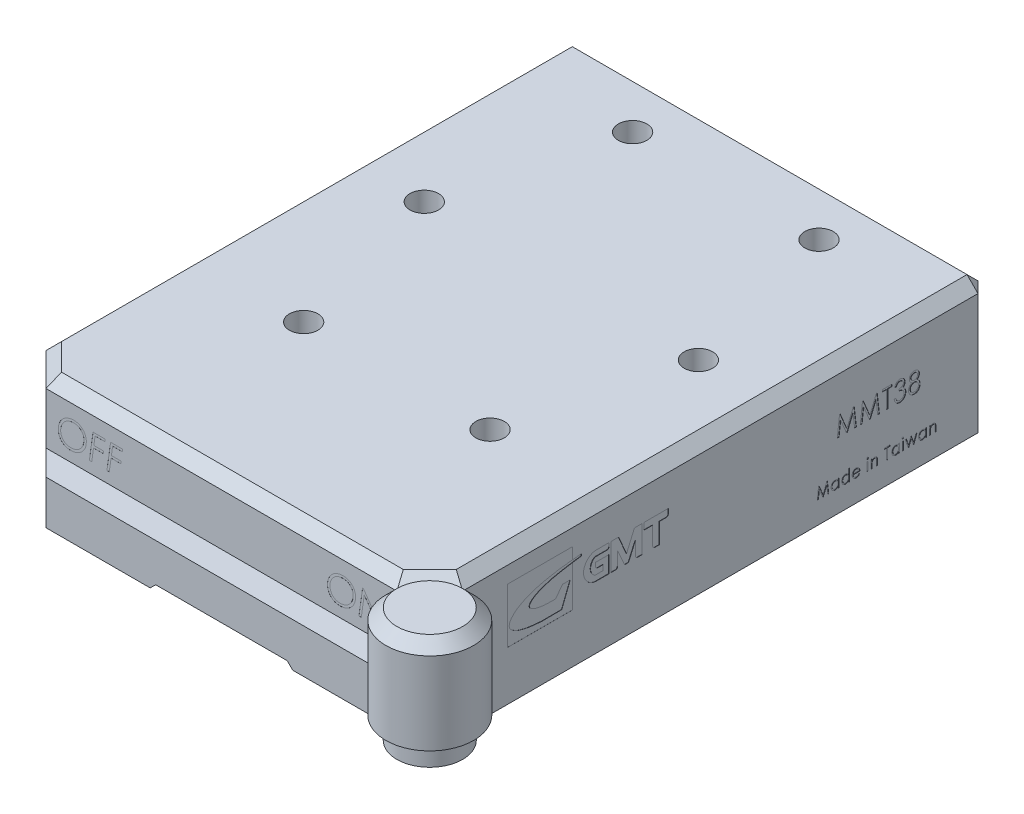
SolidWorks part; units mm, degrees
ref_plane "前基準面" through (0, 0, 0) normal (0, 0, 1) x (1, 0, 0)
ref_plane "上基準面" through (0, 0, 0) normal (0, 1, 0) x (1, 0, 0)
ref_plane "右基準面" through (0, 0, 0) normal (1, 0, 0) x (0, 0, -1)
sketch "草圖1" plane through (0, 0, 0) normal (0, 0, 1) x (1, 0, 0)
  line L0 (0, 53.9333) -> (0, 0) construction
  line L1 (-33.7631, 0) -> (44.506, 0) construction
  line L2 (-19, 0) -> (-19, 12)
  line L3 (-19, 12) -> (19, 12)
  line L4 (19, 12) -> (19, 0)
  line L5 (19, 0) -> (6, 0)
  line L6 (6, 0.5) -> (-6, 0.5)
  line L7 (-6, 0.5) -> (-6, 0)
  line L8 (-6, 0) -> (-19, 0)
  line L9 (6, 0.5) -> (6, 0)
  dimension "D1" = 12
  dimension "D2" = 38
  dimension "D3" = 13
  dimension "D4" = 0.5
extrude "伸長1" add sketch "草圖1" against normal blind 51
chamfer "導角1" distance 3 angle 45 2 edges at (-19, 6, 0) (19, 6, 0)
ref_plane "平面1" through (0, 4, 0) normal (0, 1, 0) x (-1, 0, 0)
sketch "草圖5" plane through (-19, 0, 0) normal (-1, 0, 0) x (0, 0, 1)
  line L0 (0, 12) -> (0, 0) construction
  line L1 (-4.3, 6.3) -> (0, 6.3)
  line L2 (-4.3, 6.3) -> (-4.3, 4)
  line L3 (-4.3, 4) -> (0, 4)
  line L4 (0, 6.3) -> (0, 4)
  line L5 (-51, 0) -> (-3, 0) construction
  dimension "D1" = 4
  dimension "D2" = 2.3
  dimension "D3" = 4.3
extrude "除料-伸長1" cut sketch "草圖5" against normal through all
sketch "草圖2" plane through (0, 4, 0) normal (0, 1, 0) x (-1, 0, 0)
  line L0 (0, 0) -> (0, -51) construction
  line L1 (-19, -51) -> (19, -51) construction
  line L2 (-12.4005, -10.8421) -> (-24.4213, 1.1787)
  line L3 (0, -19) -> (-31.0095, 12.0095) construction
  line L4 (-16, 0) -> (16, 0) construction
  line L5 (-20.1787, 5.4213) -> (-8.1579, -6.5995)
  line L6 (-8.1579, -6.5995) -> (-12.4005, -10.8421)
  arc A0 (-20.1787, 5.4213) -> (-24.4213, 1.1787) centre (-22.3, 3.3) ccw
  dimension "D3" = 6
  dimension "D1" = 45
  dimension "D2" = 6
  dimension "D4" = 20
  dimension "D5" = 6.3
  dimension "D6" = 32
extrude "伸長2" add sketch "草圖2" along normal blind 2
sketch "草圖3" plane through (0, 6, 0) normal (0, 1, 0) x (1, 0, 0)
  circle A0 centre (22.3, -3.3) radius 4
  dimension "D1" = 8
extrude "伸長3" add sketch "草圖3" along normal blind 8.5
sketch "草圖4" plane through (0, 4, 0) normal (0, -1, 0) x (1, 0, 0)
  circle A0 centre (22.3, 3.3) radius 1.5
  dimension "D1" = 3
extrude "伸長4" add sketch "草圖4" along normal blind 0.5
chamfer "導角2" distance 1 angle 45 9 edges at (22.3, 14.5, 7.3) (19, 6, -51) (-19, 6, -51) (0, 12, -51) (19, 12, -27) (17.5, 12, -1.5) (0, 12, 0) (-17.5, 12, -1.5) (-19, 12, -27)
chamfer "導角3" distance 0.5 angle 45 2 edges at (6, 0, -25.5) (-6, 0, -25.5)
fillet "圓角2" radius 1 1 edges at (10.4574, 5, -4.3)
hole_wizard "M3x0.5 螺紋孔1" positions "草圖9" profile "草圖8" tap size "M3x0.5" standard "JIS"
sketch "草圖9" plane through (0, 12, 0) normal (0, 1, 0) x (-1, 0, 0)
  line L0 (0, -54.1924) -> (0, 5.5667) construction
  line L2 (18, -51) -> (-18, -51) construction
  point P0 (-8.5, -46)
  point P1 (8.5, -46)
  point P3 (12.5, -31)
  point P5 (-12.5, -31)
  point P7 (8.5, -16)
  point P9 (-8.5, -16)
  dimension "D1" = 17
  dimension "D2" = 25
  dimension "D3" = 5
  dimension "D4" = 15
  dimension "D5" = 15
sketch "草圖8" plane through (8.5, 12, -46) normal (1, 0, 0) x (0, 0, 1)
  line L0 (0, 0) -> (0, 7.2811)
  line L1 (0, 7.2811) -> (1.3, 6.5)
  line L2 (1.3, 6.5) -> (1.3, 0)
  line L5 (1.3, 0) -> (0, 0)
  line L10 (0, 7.2811) -> (-1.3, 6.5) construction
  line L11 (0, -6.35) -> (0, 107.95) construction
  dimension "螺孔鑽直徑" = 2.6
  dimension "螺孔鑽深度" = 6.5
  dimension "導頭角度" = 118
sketch "草圖10" plane through (0, 0, 0) normal (0, 0, 1) x (1, 0, 0)
  line L0 (-15, 7.3) -> (15, 7.3) construction
  line L1 (-19, 6.3) -> (-19, 11) construction
  line L4 (19, 6.3) -> (-19, 6.3) construction
  text T0 "<i>OFF                    ON</i>" font "Century Gothic" height 2.4
  dimension "D1" = 4
  dimension "D2" = 1
extrude "除料-伸長2" cut sketch "草圖10" against normal blind 0.005
sketch "草圖11" plane through (19, 0, 0) normal (1, 0, 0) x (0, 0, -1)
  line L0 (51, 11) -> (51, 0) construction
  line L1 (3.4142, 12) -> (50, 12) construction
  line L2 (7.1, 9.5) -> (13, 9.5)
  line L3 (7.1, 9.5) -> (7.1, 4.5)
  line L4 (7.1, 4.5) -> (13, 4.5)
  line L5 (13, 9.5) -> (13, 4.5)
  dimension "D1" = 5
  dimension "D2" = 5.9
  dimension "D3" = 38
  dimension "D4" = 2.5
extrude "除料-伸長3" cut sketch "草圖11" against normal blind 0.005
sketch "草圖12"
  dimension "D1" = 2
  dimension "D3" = 4
extrude "除料-伸長4" cut sketch "草圖12" along normal blind 0.03
